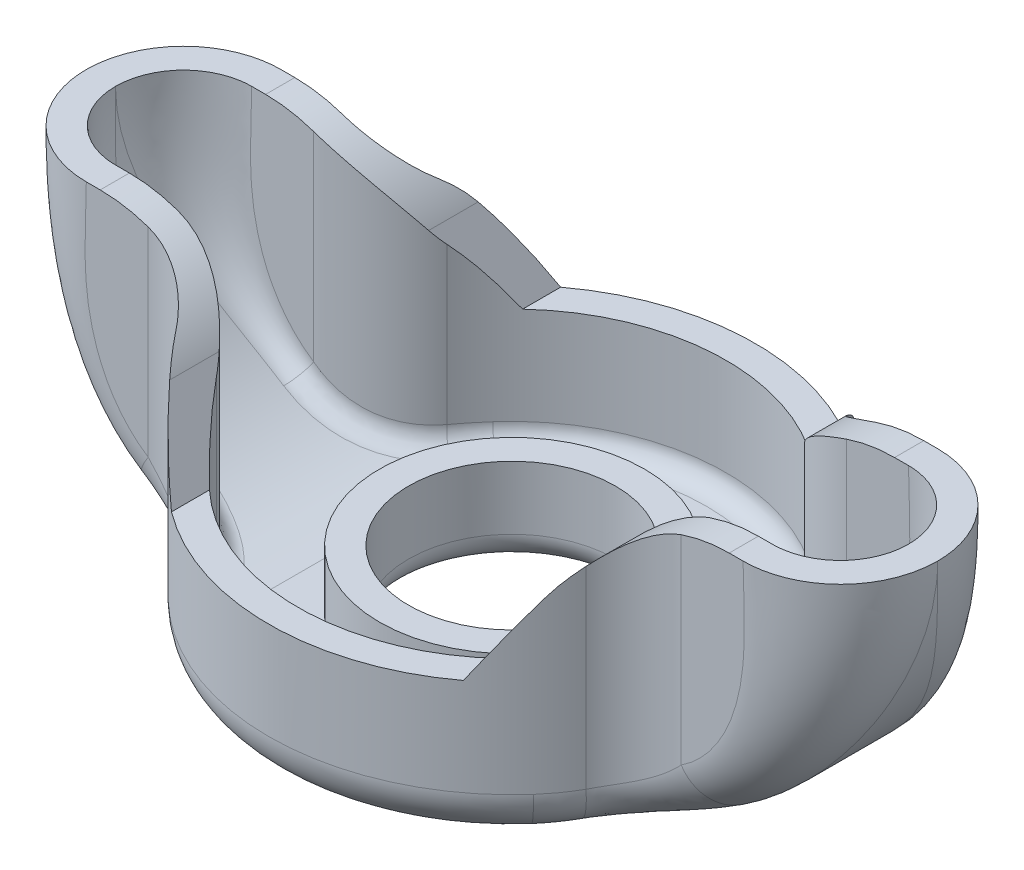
SolidWorks part; units mm, degrees
ref_plane "Front Plane" through (0, 0, 0) normal (0, 0, 1) x (1, 0, 0)
ref_plane "Top Plane" through (0, 0, 0) normal (0, 1, 0) x (1, 0, 0)
ref_plane "Right Plane" through (0, 0, 0) normal (1, 0, 0) x (0, 0, -1)
sketch "BaseNutSke" plane through (0, 0, 0) normal (0, 1, 0) x (1, 0, 0)
  line L0 (0, 73.6257) -> (0, -72.8166) construction
  line L1 (17.5, -4) -> (9.1652, -4)
  line L2 (-17.5, -4) -> (-9.1652, -4)
  line L3 (0, 0) -> (40.2198, 0) construction
  line L4 (-17.5, 4) -> (-9.1652, 4)
  line L5 (17.5, 4) -> (9.1652, 4)
  line L6 (-17.5, 4) -> (-17.5, -4)
  line L7 (17.5, -4) -> (17.5, 4)
  arc A0 (-9.1652, -4) -> (9.1652, -4) centre (0, 0) ccw
  arc A2 (9.1652, 4) -> (-9.1652, 4) centre (0, 0) ccw
  dimension "Nut_width" = 20
  dimension "Length" = 35
  dimension "Wing_width" = 8
extrude "BaseNut" add sketch "BaseNutSke" against normal blind 12
sketch "CutNutSke" plane through (0, 0, 0) normal (0, 0, 1) x (1, 0, 0)
  line L0 (0, 0) -> (0, -18.7628) construction
  line L1 (-17.5, 0) -> (-12.9282, 0)
  line L2 (-7.7321, -3) -> (-6, -6)
  line L3 (-6, -6) -> (6, -6)
  line L4 (6, -12) -> (-6, -12)
  line L5 (-9.1652, -12) -> (9.1652, -12) construction
  line L6 (-17.5, 0) -> (-17.5, 13.115) construction
  line L8 (-17.5, -12) -> (-17.5, 0) construction
  line L10 (17.5, 0) -> (12.9282, 0)
  line L11 (7.7321, -3) -> (6, -6)
  line L12 (-17.5, -12) -> (-17.5, 0) construction
  line L13 (-25, 3) -> (25, 3)
  line L14 (-25, 3) -> (-25, -17)
  line L15 (-25, -17) -> (25, -17)
  line L16 (25, 3) -> (25, -17)
  line L17 (-17.5, 0) -> (-9.1652, 0) construction
  line L18 (-17.5, 0) -> (-9.1652, 0) construction
  arc A1 (-12.9282, 0) -> (-7.7321, -3) centre (-12.9282, -6) cw
  arc A3 (12.9282, 0) -> (7.7321, -3) centre (12.9282, -6) ccw
  ellipse E0 centre (6, 0) end of major axis (6, -12) minor radius 11.5 (6, -12) -> (17.5, 0) ccw
  ellipse E1 centre (-6, 0) end of major axis (-6, -12) minor radius 11.5 (-6, -12) -> (-17.5, 0) cw
  point P18 (0, -12)
  point P24 (0, -6)
  dimension "D3" = 6
  dimension "D4" = 50
  dimension "D1" = 3
  dimension "Base_width" = 12
  dimension "D2" = 20
  dimension "Base_height" = 6
  dimension "Wing_ang" = 30
extrude "CutNut" cut sketch "CutNutSke" against normal mid plane 20
fillet "Fillet1" radius 3 4 edges at (-9.1652, -6.4316, 4) (9.1652, -6.4316, 4) (-9.1652, -6.4316, -4) (9.1652, -6.4316, -4)
fillet "WingFillet" radius 2 4 edges at (15.7269, -6.4016, 4) (15.7269, -6.4016, -4) (-15.7269, -6.4016, -4) (-15.7269, -6.4016, 4)
sketch "HoleSke" plane through (0, -12, 0) normal (0, -1, 0) x (1, 0, 0)
  circle A0 centre (0, 0) radius 4.25
  dimension "Tap_drill" = 8.5
extrude "TappedHole" cut sketch "HoleSke" against normal blind 3.8
fillet "HoleFillet" radius 1.2 1 edges at (0, -12, -4.25)
shell "NutShell" thickness 1.2
sketch "HTSke" plane through (0, -8.2, 0) normal (0, 1, 0) x (1, 0, 0)
  circle A0 centre (0, 0) radius 4.25 construction
  circle A1 centre (0, 0) radius 5.45
  circle A2 centre (0, 0) radius 5.45
  circle A3 centre (0, 0) radius 4.25
  dimension "D1" = 0
extrude "HightType" [suppressed] add sketch "HTSke" along normal blind 3.2
sketch "ThdSchSke" plane through (0, 0, 0) normal (0, 0, 1) x (1, 0, 0)
  line L0 (-4.25, -10.8) -> (4.25, -10.8) construction
  line L1 (-4.25, -10.8) -> (4.25, -10.8) construction
  line L2 (-4.25, -10.8) -> (-5, -10.367)
  line L3 (-5, -10.367) -> (-4.25, -9.934)
  line L4 (-4.25, -9.934) -> (-3.384, -9.934)
  line L5 (-3.384, -9.934) -> (-3.384, -10.8)
  line L6 (-3.384, -10.8) -> (-4.25, -10.8)
  line L7 (0, 0) -> (0, -20.3332) construction
  dimension "ThreadN" = 10
revolve "ThreadSchematic" [suppressed] cut sketch "ThdSchSke" angle 360 about L7
pattern_linear "ThdSchPat" [suppressed] count 6 along (0, -1, 0)
equation "\"D3@CutNutSke\" = \"Base_width@CutNutSke\"/2"
equation "\"D1@CutNut\" = \"Nut_width@BaseNutSke\""
equation "\"D1@Fillet1\" = \"Nut_width@BaseNutSke\"*0.15"
equation "\"D3@WingFillet\" = \"Wing_width@BaseNutSke\"/2"
equation "\"D0@WingFillet\" = \"Wing_width@BaseNutSke\"/2"
equation "\"D7@WingFillet\" = \"Wing_width@BaseNutSke\"/2"
equation "\"D4@WingFillet\" = \"Wing_width@BaseNutSke\"/2"
equation "\"D5@WingFillet\" = \"Wing_width@BaseNutSke\"/4"
equation "\"D2@WingFillet\" = \"Wing_width@BaseNutSke\"/4"
equation "\"D6@WingFillet\" = \"Wing_width@BaseNutSke\"/4"
equation "\"D1@WingFillet\" = \"Wing_width@BaseNutSke\"/4"
equation "\"D1@NutShell\" = \"Thickness@HoleFillet\""
equation "\"ThreadN@ThdSchSke\" = \"Thread_major@ThreadCosmetic\""
equation "\"D1@ThdSchPat\" =  int( \"Inner_Hole_Low@TappedHole\"/\"Advance@ThdSchPat\" ) *2+2"
